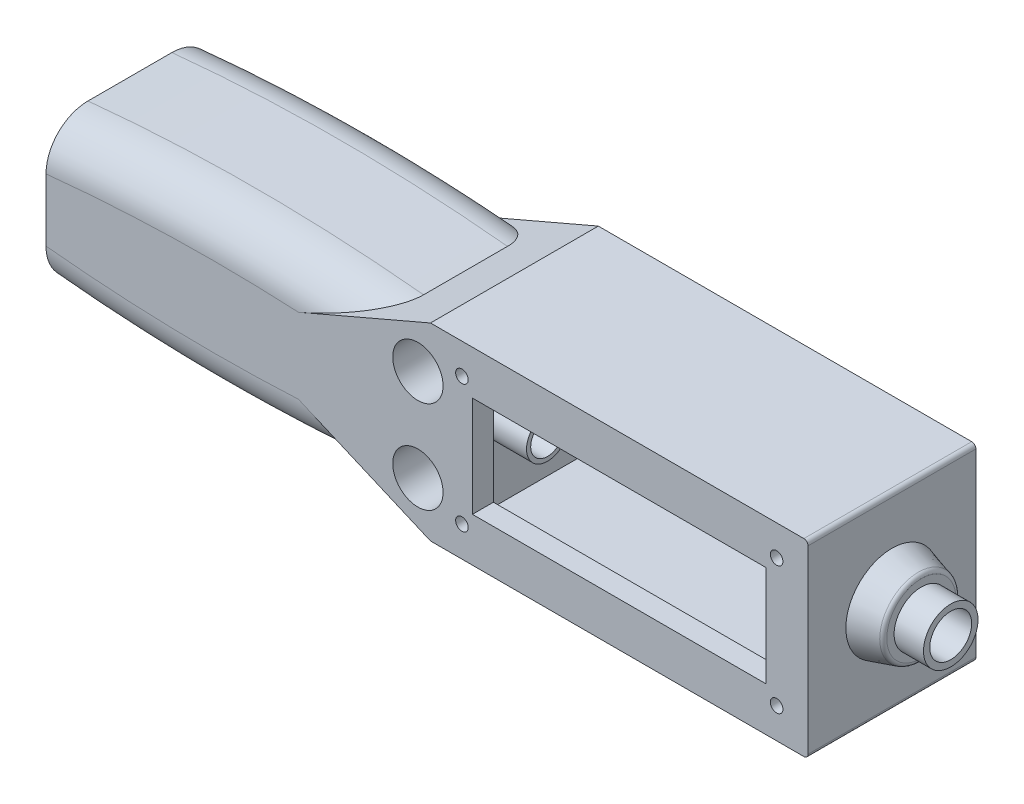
SolidWorks part; units mm, degrees
ref_plane "Alzado" through (0, 0, 0) normal (0, 0, 1) x (1, 0, 0)
ref_plane "Planta" through (0, 0, 0) normal (0, 1, 0) x (1, 0, 0)
ref_plane "Vista lateral" through (0, 0, 0) normal (1, 0, 0) x (0, 0, -1)
sketch "Croquis1" plane through (0, 0, 0) normal (0, 0, 1) x (1, 0, 0)
  line L0 (-45, 22.5) -> (-56.6374, 17.5)
  line L1 (-35, 12) -> (35, 12)
  line L2 (-35, 12) -> (-35, -12)
  line L3 (-35, -12) -> (35, -12)
  line L4 (35, 12) -> (35, -12)
  line L5 (-35, 12) -> (35, -12) construction
  line L6 (-35, -12) -> (35, 12) construction
  line L7 (-45, 22.5) -> (45, 22.5)
  line L8 (-45, 22.5) -> (-45, -22.5)
  line L9 (-45, -22.5) -> (45, -22.5)
  line L10 (45, 22.5) -> (45, -22.5)
  line L11 (-45, 22.5) -> (45, -22.5) construction
  line L12 (-45, -22.5) -> (45, 22.5) construction
  line L13 (-45, -22.5) -> (-56.6374, -17.5)
  line L14 (-56.6374, -17.5) -> (-56.6374, 17.5)
  line L15 (-126.6374, 0) -> (-56.6374, 0)
  line L16 (-56.6374, 17.5) -> (-126.6374, 17.5)
  line L17 (-56.6374, 17.5) -> (-56.6374, -17.5)
  line L18 (-56.6374, -17.5) -> (-126.6374, -17.5)
  line L19 (-126.6374, 17.5) -> (-126.6374, -17.5)
  line L20 (-37.5, 15.25) -> (-38.4608, 16.4019) construction
  line L25 (-40.3992, 16.8141) -> (40.4019, -16.8152) construction
  line L26 (-39.5765, -18.6752) -> (39.5765, 18.6752) construction
  line L27 (39.5765, 18.6752) -> (35, 12) construction
  line L28 (40.4019, -16.8152) -> (35, -12) construction
  line L29 (-35, -12) -> (-39.5765, -18.6752) construction
  line L30 (0, 22.5) -> (0, -22.5) construction
  line L31 (-45, 0) -> (45, 0) construction
  circle A0 centre (-37.5, 15.25) radius 1.5
  circle A1 centre (37.5, 15.25) radius 1.5
  circle A2 centre (-37.5, -15.25) radius 1.5
  circle A3 centre (37.5, -15.25) radius 1.5
  point P0 (0, 0)
  point P6 (0, 0)
  point P17 (0, 0)
  point P24 (-37.5, 16.75)
  point P25 (-39, 15.25)
  dimension "D1" = 24
  dimension "D2" = 70
  dimension "D3" = 90
  dimension "D4" = 45
  dimension "D5" = 70
  dimension "D6" = 35.5
  dimension "D7" = 80
extrude "Saliente-Extruir1" add sketch "Croquis1" along normal blind 35 contours L14 L13 L8 L0 | L10 L7 L8 L9 L1 L4 L3 L2
sketch "Croquis3" plane through (0, 0, 0) normal (0, 0, -1) x (-1, 0, 0)
  line L0 (56.6374, 17.5) -> (45, 22.5)
  line L1 (45, 22.5) -> (-45, 22.5)
  line L2 (-45, 22.5) -> (-45, -22.5)
  line L3 (-45, -22.5) -> (45, -22.5)
  line L4 (45, -22.5) -> (56.6374, -17.5)
  line L5 (56.6374, -17.5) -> (56.6374, 17.5)
extrude "Saliente-Extruir2" add sketch "Croquis3" along normal blind 5
sketch "Croquis6" plane through (0, 0, 35) normal (0, 0, 1) x (1, 0, 0)
  line L1 (-136.6374, 17.5) -> (-136.6374, -17.5)
  line L9 (-56.6374, 17.5) -> (-56.6374, -17.5)
  line L10 (-56.6374, -17.5) -> (-45, -22.5)
  line L11 (-45, -22.5) -> (45, -22.5)
  line L12 (45, -22.5) -> (45, 22.5)
  line L13 (45, 22.5) -> (-45, 22.5)
  line L14 (-45, 22.5) -> (-56.6374, 17.5)
  line L15 (-56.6374, 17.5) -> (-56.6374, -17.5)
  arc A0 (-136.6374, 17.5) -> (-56.6374, 17.5) centre (-96.6374, -380.495) cw
  arc A1 (-56.6374, -17.5) -> (-136.6374, -17.5) centre (-96.6374, 380.495) cw
  dimension "D3" = 400
  dimension "D4" = 400
  dimension "D1" = 35
  dimension "D2" = 80
  dimension "D5" = 0
extrude "Saliente-Extruir3" add sketch "Croquis6" against normal through all
fillet "Redondeo3" radius 10 1 edges at (-96.6374, 19.505, -5)
fillet "Redondeo4" radius 10 1 edges at (-96.6374, -19.505, -5)
fillet "Redondeo8" radius 10 1 edges at (-96.6374, 19.505, 35)
fillet "Redondeo9" radius 10 1 edges at (-96.6374, -19.505, 35)
sketch "Croquis12" plane through (0, 0, 0) normal (0, 0, 1) x (1, 0, 0)
  line L1 (40, 18) -> (-40, 18)
  line L2 (40, 18) -> (40, -18)
  line L3 (40, -18) -> (-40, -18)
  line L4 (-40, 18) -> (-40, -18)
  line L5 (40, 18) -> (-40, -18) construction
  line L6 (40, -18) -> (-40, 18) construction
  point P0 (0, 0)
  dimension "D1" = 80
  dimension "D2" = 36
extrude "Cortar-Extruir2" cut sketch "Croquis12" along normal blind 30 and the other way blind 20
sketch "Croquis13" plane through (0, 0, 0) normal (0, 0, 1) x (1, 0, 0)
  line L1 (40, 18) -> (-40, 18)
  line L2 (40, 18) -> (40, -18)
  line L3 (40, -18) -> (-40, -18)
  line L4 (-40, 18) -> (-40, -18)
  line L5 (40, 18) -> (-40, -18) construction
  line L6 (40, -18) -> (-40, 18) construction
  point P0 (0, 0)
extrude "Saliente-Extruir7" add sketch "Croquis13" along normal blind 2.5 and the other way blind 5
sketch "Croquis16" plane through (45, 0, 0) normal (1, 0, 0) x (0, 0, -1)
  line L0 (5, 22.5) -> (-35, -22.5) construction
  line L1 (-35, 22.5) -> (5, -22.5) construction
  circle A0 centre (-15, 0) radius 11
  dimension "D1" = 22
extrude "Saliente-Extruir8" add sketch "Croquis16" along normal blind 7 draft 16
fillet "Redondeo12" radius 1 1 edges at (52, 0, 6.0072)
sketch "Croquis27" plane through (52, 0, 0) normal (1, 0, 0) x (0, 0, -1)
  circle A0 centre (-15, 0) radius 6.5
  circle A1 centre (-15, 0) radius 5
  dimension "D1" = 13
  dimension "D2" = 10
extrude "Saliente-Extruir12" add sketch "Croquis27" along normal blind 7
sketch "Croquis28" plane through (52, 0, 0) normal (1, 0, 0) x (0, 0, -1)
  circle A0 centre (-15, 0) radius 5
extrude "Cortar-Extruir12" cut sketch "Croquis28" against normal blind 25
sketch "Croquis29" plane through (40, 0, 0) normal (-1, 0, 0) x (0, 0, 1)
  circle A0 centre (15, 0) radius 5
  circle A1 centre (15, 0) radius 4
  dimension "D1" = 8
extrude "Saliente-Extruir13" add sketch "Croquis29" along normal blind 10 separate body
sketch "Croquis30" plane through (-136.6374, 0, 0) normal (-1, 0, 0) x (0, 0, 1)
  line L0 (15, 17.5) -> (15, -17.5) construction
  line L1 (5, 17.5) -> (25, 17.5) construction
  line L2 (5, -17.5) -> (25, -17.5) construction
  line L3 (0, 0) -> (30, 0) construction
  line L4 (2, 7.5) -> (28, 7.5)
  line L5 (0, 5.5) -> (0, -5.5)
  line L6 (2, -7.5) -> (28, -7.5)
  line L7 (30, 5.5) -> (30, -5.5)
  circle A1 centre (7.89, 0) radius 4
  circle A2 centre (22.11, 0) radius 5
  circle A3 centre (7.89, 0) radius 5
  circle A4 centre (22.11, 0) radius 4
  arc A5 (28, -7.5) -> (30, -5.5) centre (28, -5.5) ccw
  arc A6 (28, 7.5) -> (30, 5.5) centre (28, 5.5) cw
  arc A7 (0, -5.5) -> (2, -7.5) centre (2, -5.5) ccw
  arc A8 (0, 5.5) -> (2, 7.5) centre (2, 5.5) cw
  point P6 (15, 0)
  point P17 (12.89, 0)
  point P18 (17.11, 0)
  point P23 (30, -7.5)
  point P28 (0, -7.5)
  point P31 (0, 7.5)
  dimension "D3" = 8
  dimension "D4" = 10
  dimension "D7" = 10
  dimension "D8" = 8
  dimension "D9" = 2
  dimension "D1" = 2.11
  dimension "D2" = 2.11
  dimension "D5" = 15
  dimension "D6" = 30
extrude "Cortar-Extruir14" cut sketch "Croquis30" against normal blind 12 contours A8 L5 A7 L6 A5 L7 A6 L4 A3 A2
sketch "Croquis31" plane through (-136.6374, 0, 0) normal (-1, 0, 0) x (0, 0, 1)
  circle A0 centre (22.11, 0) radius 4
  circle A1 centre (7.89, 0) radius 4
  dimension "D1" = 8
  dimension "D2" = 8
extrude "Cortar-Extruir15" cut sketch "Croquis31" against normal blind 105 and the other way through all
sketch "Croquis32" plane through (-40, 0, 0) normal (1, 0, 0) x (0, 0, -1)
  circle A0 centre (-7.89, 0) radius 5
  circle A1 centre (-22.11, 0) radius 5
  circle A2 centre (-7.89, 0) radius 4
  circle A3 centre (-22.11, 0) radius 4
  dimension "D1" = 8
  dimension "D2" = 10
  dimension "D3" = 10
  dimension "D4" = 8
extrude "Saliente-Extruir14" add sketch "Croquis32" along normal blind 10
fillet "Redondeo13" radius 1 2 edges at (45, -22.5, 15) (45, 22.5, 15)
sketch "Croquis33" plane through (0, 0, 35) normal (0, 0, 1) x (1, 0, 0)
  line L0 (-56.6374, 17.5) -> (-56.6374, -17.5) construction
  line L1 (-45, 22.5) -> (-45, -22.5) construction
  line L2 (-136.6374, 0) -> (-35, 0) construction
  line L3 (-136.6374, 7.4483) -> (-136.6374, -7.4483) construction
  line L4 (-35, 12) -> (-35, -12) construction
  line L5 (-56.6374, 0) -> (-45, 0)
  circle A0 centre (-48, 11) radius 6
  circle A1 centre (-48, -11) radius 6
  point P16 (-42, 11)
  point P17 (-42, -11)
  point P23 (-48, 5)
  point P24 (-48, -5)
  dimension "D1" = 12
  dimension "D2" = 12
  dimension "D3" = 7
  dimension "D4" = 7
extrude "Cortar-Extruir17" cut sketch "Croquis33" against normal blind 30 contours A1 | A0
